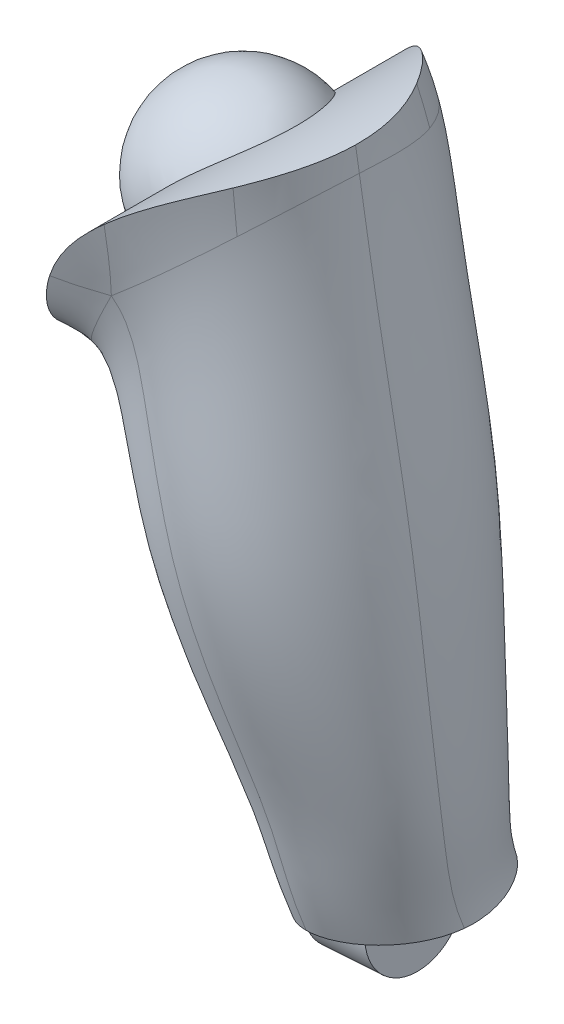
SolidWorks part; units mm, degrees
ref_plane "Front Plane" through (0, 0, 0) normal (0, 0, 1) x (1, 0, 0)
ref_plane "Top Plane" through (0, 0, 0) normal (0, 1, 0) x (1, 0, 0)
ref_plane "Right Plane" through (0, 0, 0) normal (1, 0, 0) x (0, 0, -1)
imported_body "Stock-Source-1"
ref_plane "Plane1" through (0, 0, 88.9) normal (0, 0, 1) x (1, 0, 0)
sketch "Sketch1" plane through (0, 0, 88.9) normal (0, 0, 1) x (1, 0, 0)
  line L0 (91.316, 3691.181) -> (15.624, 3593.645)
  line L1 (91.316, 3691.181) -> (91.316, 3593.645) construction
  line L2 (91.316, 3593.645) -> (15.624, 3593.645) construction
  arc A0 (119.4729, 3703.7036) -> (66.0745, 3673.5035) centre (170.2519, 3551.6103) ccw construction
  arc A1 (15.624, 3593.645) -> (91.316, 3691.181) centre (53.47, 3642.413) cw
  dimension "D1" = 97.536
  dimension "D2" = 75.692
revolve "Revolve1" add sketch "Sketch1" angle 360 about L0
sketch "Sketch2" plane through (0, 0, 88.9) normal (0, 0, 1) x (1, 0, 0)
  line L0 (130.8332, 3248.6252) -> (174.462, 3251.4268)
  line L1 (116.3893, 3247.6977) -> (145.277, 3249.5527) construction
  line L2 (145.277, 3249.5527) -> (203.647, 3253.3009) construction
  line L3 (174.462, 3251.4268) -> (176.7001, 3216.5736)
  line L4 (176.7001, 3216.5736) -> (133.0713, 3213.772)
  line L5 (133.0713, 3213.772) -> (130.8332, 3248.6252)
  dimension "D1" = 34.925
revolve "Revolve2" add sketch "Sketch2" angle 360 about L0
